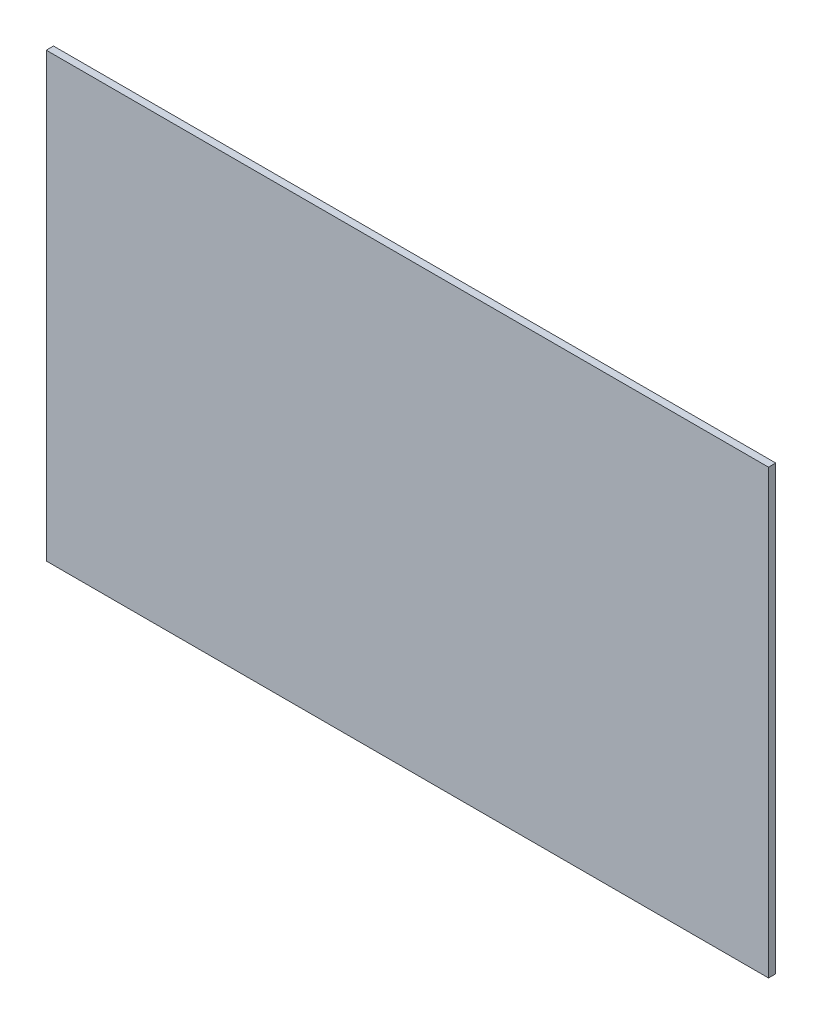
SolidWorks part; units mm, degrees
ref_plane "Front Plane" through (0, 0, 0) normal (0, 0, 1) x (1, 0, 0)
ref_plane "Top Plane" through (0, 0, 0) normal (0, 1, 0) x (1, 0, 0)
ref_plane "Right Plane" through (0, 0, 0) normal (1, 0, 0) x (0, 0, -1)
sketch "Sketch2" plane through (0, 0, 0) normal (0, 0, 1) x (1, 0, 0)
  line L1 (-60, 36.75) -> (60, 36.75)
  line L2 (-60, 36.75) -> (-60, -36.75)
  line L3 (-60, -36.75) -> (60, -36.75)
  line L4 (60, 36.75) -> (60, -36.75)
  dimension "D1" = 120
  dimension "D2" = 60
  dimension "D3" = 73.5
  dimension "D4" = 36.75
extrude "Boss-Extrude1" add sketch "Sketch2" along normal blind 1.2
